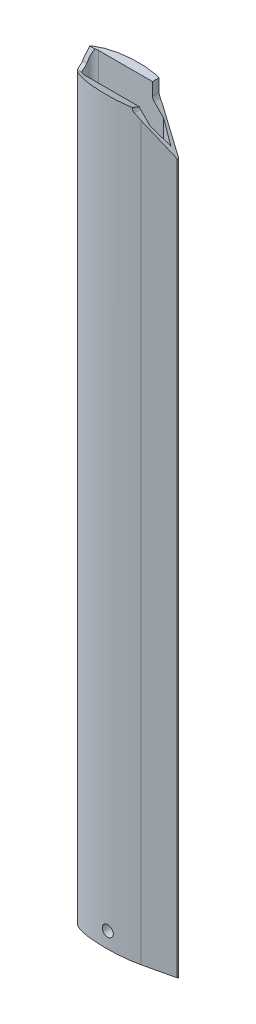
SolidWorks part; units mm, degrees
ref_plane "Front Plane" through (0, 0, 0) normal (0, 0, 1) x (1, 0, 0)
ref_plane "Top Plane" through (0, 0, 0) normal (0, 1, 0) x (1, 0, 0)
ref_plane "Right Plane" through (0, 0, 0) normal (1, 0, 0) x (0, 0, -1)
sketch "Sketch3" plane through (0, 0, 0) normal (1, 0, 0) x (0, 0, -1)
  line L0 (0, 0) -> (0, 215.9233) construction
  line L1 (0, 215.9233) -> (47.8066, 233.1038) construction
  line L2 (47.8066, 233.1038) -> (185.2506, 66.5744) construction
  line L3 (185.2506, 66.5744) -> (0, 0) construction
  line L4 (23.9033, 224.5136) -> (92.6253, 33.2872) construction
  line L5 (-4.7625, 217.6349) -> (4.7625, 217.6349) construction
  line L6 (-4.7625, -1.7115) -> (4.7625, -1.7115) construction
  line L7 (0, 215.9233) -> (-2.1476, 221.8992) construction
  line L8 (-2.1476, 221.8992) -> (45.659, 239.0797) construction
  line L9 (45.659, 239.0797) -> (47.8066, 233.1038) construction
  line L10 (-4.7625, 217.6349) -> (-4.7625, 220.9594) construction
  line L11 (-4.7625, 220.9594) -> (-2.1476, 221.8992) construction
  point P9 (0, 217.6349)
  point P12 (0, -1.7115)
  dimension "D1" = 203.2
  dimension "D2" = 196.85
  dimension "D3" = 50.8
  dimension "D4" = 9.525
  dimension "D5" = 6.35
sketch "Sketch1" plane through (0, 0, 0) normal (0, 1, 0) x (1, 0, 0)
  line L0 (0, 0) -> (19.05, 0) construction
  line L1 (0, 1.9812) -> (19.05, 1.9812)
  line L2 (0, -1.9812) -> (19.05, -1.9812)
  line L3 (19.05, 1.9812) -> (23.1648, 0)
  line L4 (23.1648, 0) -> (19.05, -1.9812)
  line L5 (17.697, 3.2923) -> (25.166, 0.2351)
  line L6 (25.166, -0.2351) -> (17.697, -3.2923)
  arc A0 (0, 1.9812) -> (0, -1.9812) centre (0, 0) ccw
  arc A1 (25.166, -0.2351) -> (25.166, 0.2351) centre (25.0698, 0) ccw
  ellipse E0 centre (8.9099, 0) end of major axis (-3.2512, 0) minor radius 4.7625 (17.697, 3.2923) -> (17.697, -3.2923) ccw
  point P18 (25.3238, 0)
  point P19 (-1.9812, 0)
  dimension "D3" = 0.254
  dimension "D1" = 3.9624
  dimension "D2" = 19.05
  dimension "D4" = 9.525
  dimension "D5" = 28.575
  dimension "D6" = 1.905
  dimension "D7" = 1.27
extrude "Boss-Extrude1" add sketch "Sketch1" along normal up to vertex and the other way up to vertex
sketch "Sketch4" plane through (0, 0, 0) normal (1, 0, 0) x (0, 0, -1)
  line L0 (-2.1476, 221.8992) -> (-0.5369, 217.4173)
  line L1 (1.494, 216.4602) -> (23.9033, 224.5136)
  line L2 (23.9033, 224.5136) -> (21.7557, 230.4894)
  line L5 (-4.7625, -1.7115) -> (4.7625, 1.7115)
  line L6 (185.2506, 66.5744) -> (0, 0) construction
  line L7 (4.7625, 1.7115) -> (4.7625, -1.7115)
  line L8 (4.7625, -1.7115) -> (-4.7625, -1.7115)
  line L9 (4.7625, -1.7115) -> (4.7625, 220.9594) construction
  line L10 (21.7557, 230.4894) -> (-2.1476, 221.8992)
  arc A0 (1.494, 216.4602) -> (-0.5369, 217.4173) centre (0.9571, 217.9542) cw
  point P8 (0, 215.9233)
  dimension "D1" = 1.5875
extrude "Cut-Extrude1" cut sketch "Sketch4" against normal through all both and the other way through all
sketch "Sketch5" plane through (0, 0, 0) normal (0, 0, 1) x (1, 0, 0)
  line L0 (16.2638, 216.1704) -> (25.3238, 207.1103)
  line L2 (25.3238, 0) -> (25.3238, 216.6876) construction
  line L3 (25.3238, 207.1103) -> (25.3238, 269.527)
  line L4 (25.3238, 269.527) -> (15.7988, 269.527)
  line L5 (15.7988, 269.527) -> (15.7988, 217.2929)
  line L6 (-3.2512, 216.6876) -> (-3.2512, 0) construction
  line L7 (0, 216.6353) -> (19.05, 216.6353) construction
  arc A0 (16.2638, 216.1704) -> (15.7988, 217.2929) centre (17.3863, 217.2929) cw
  point P12 (15.7988, 216.6353)
  dimension "D3" = 1.5875
  dimension "D1" = 45
  dimension "D2" = 19.05
extrude "Cut-Extrude2" cut sketch "Sketch5" against normal through all both and the other way through all
mirror "Mirror1" about plane through (0, 0, 0) normal (0, 0, 1) of "Cut-Extrude2", "Boss-Extrude1", "Cut-Extrude1"
sketch "Sketch6" plane through (0, 0, 0) normal (0, 0, 1) x (1, 0, 0)
  line L0 (-3.2512, 216.6876) -> (-3.2512, 0) construction
  circle A0 centre (9.4488, 6.35) radius 1.5875
  dimension "D1" = 3.175
  dimension "D2" = 12.7
  dimension "D3" = 6.35
extrude "Cut-Extrude3" cut sketch "Sketch6" against normal through all both and the other way through all
